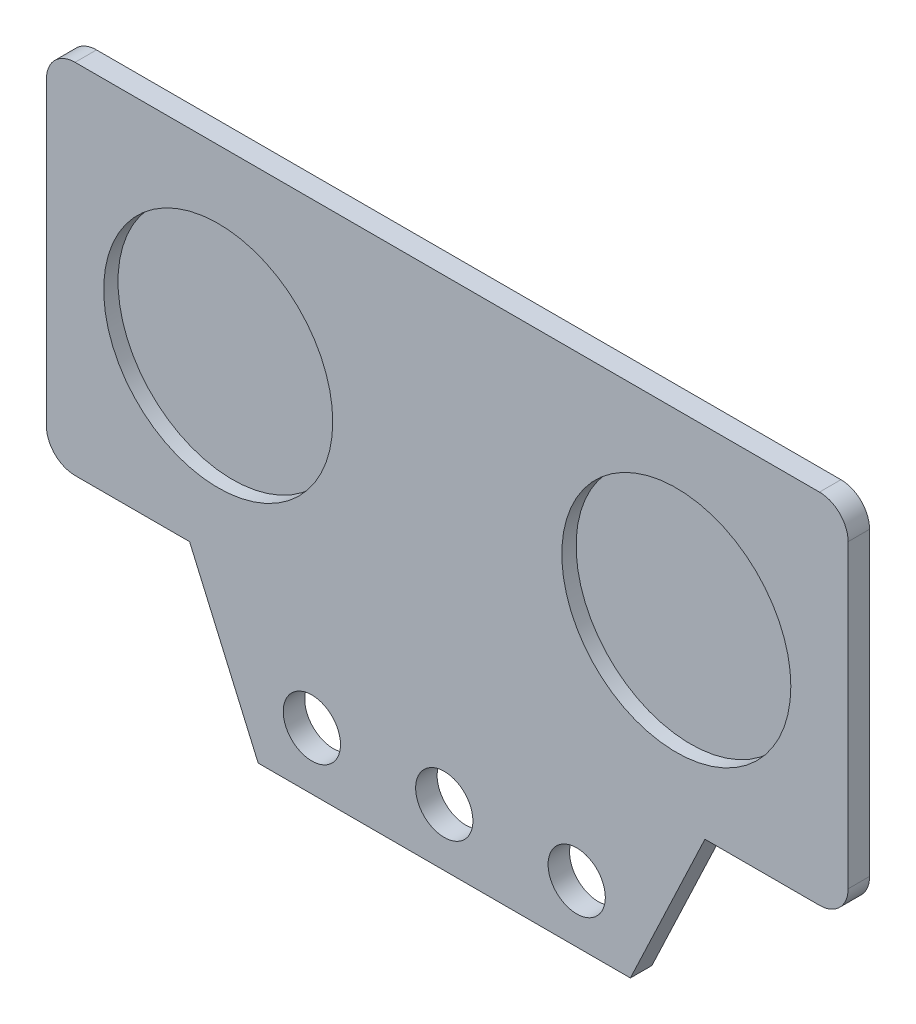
SolidWorks part; units mm, degrees
ref_plane "Plan de face" through (0, 0, 0) normal (0, 0, 1) x (1, 0, 0)
ref_plane "Plan de dessus" through (0, 0, 0) normal (0, 1, 0) x (1, 0, 0)
ref_plane "Plan de droite" through (0, 0, 0) normal (1, 0, 0) x (0, 0, -1)
ref_plane "Plan1" through (0, 0, 1.5) normal (0, 0, 1) x (1, 0, 0)
sketch "Esquisse1" plane through (0, 0, 1.5) normal (0, 0, 1) x (1, 0, 0)
  line L0 (0, -11) -> (56, -11)
  line L1 (56, -11) -> (56, 25)
  line L2 (56, 25) -> (0, 25)
  line L3 (0, 25) -> (0, -11)
extrude "Boss.-Extru.1" add sketch "Esquisse1" against normal blind 1.5
sketch "Esquisse2" plane through (0, 0, 0) normal (0, 0, -1) x (-1, 0, 0)
  line L0 (-40.7916, 0) -> (-56, 0)
  line L1 (-56, 0) -> (-56, -11)
  line L2 (-56, -11) -> (-40.7916, -11)
  line L3 (-40.7916, -11) -> (-40.7916, 0)
extrude "Enlèv. mat.-Extru.1" cut sketch "Esquisse2" against normal through all
sketch "Esquisse3" plane through (0, 0, 0) normal (0, 0, -1) x (-1, 0, 0)
  line L0 (0, 0) -> (-14.7916, 0)
  line L1 (-14.7916, 0) -> (-14.7916, -11)
  line L2 (-14.7916, -11) -> (0, -11)
  line L3 (0, -11) -> (0, 0)
extrude "Enlèv. mat.-Extru.2" cut sketch "Esquisse3" against normal through all
draft "Dépouille1" type of draft neutral plane draft angle 23.538 faces to draft 1 parameters "D1"=23.538
draft "Dépouille2" type of draft neutral plane draft angle 25.337 faces to draft 1 parameters "D1"=25.337
hole_wizard "Diamètre du perçage Ø4.0 (4)1" positions "Esquisse5" profile "Esquisse4" hole size "Ø4.0" standard "Ansi Metric"
sketch "Esquisse5" plane through (0, 0, 1.5) normal (0, 0, 1) x (1, 0, 0)
  point P0 (37.0416, -7)
  point P1 (18.5416, -7)
  point P2 (27.7916, -7)
sketch "Esquisse4" plane through (37.0416, -7, 1.5) normal (1, 0, 0) x (0, -1, 0)
  line L0 (0, 0) -> (0, 1.5)
  line L1 (0, 1.5) -> (2, 1.5)
  line L2 (2, 1.5) -> (2, 0)
  line L5 (2, 0) -> (0, 0)
  line L11 (0, -6.35) -> (0, 107.95) construction
  dimension "Diamètre du perçage jusqu'au prochain" = 4
  dimension "Profondeur du perçage jusqu'au prochain" = 1.5
hole_wizard "Diamètre du perçage Ø16.0 (16)1" positions "Esquisse7" profile "Esquisse6" hole size "Ø16.0" standard "Ansi Metric"
sketch "Esquisse7" plane through (0, 0, 1.5) normal (0, 0, 1) x (1, 0, 0)
  point P0 (44, 12.2509)
  point P1 (12, 12.2509)
sketch "Esquisse6" plane through (44, 12.2509, 1.5) normal (1, 0, 0) x (0, -1, 0)
  line L0 (0, 0) -> (0, 1)
  line L1 (0, 1) -> (8, 1)
  line L2 (8, 1) -> (8, 0)
  line L5 (8, 0) -> (0, 0)
  line L10 (0, 1) -> (-8, 1) construction
  line L11 (0, -6.35) -> (0, 107.95) construction
  dimension "Diamètre du perçage" = 16
  dimension "Profondeur du perçage" = 1
  dimension "Angle de pointe" = 180
fillet "Congé1" radius 2 4 edges at (0, 0, 0.75) (0, 25, 0.75) (56, 0, 0.75) (56, 25, 0.75)
